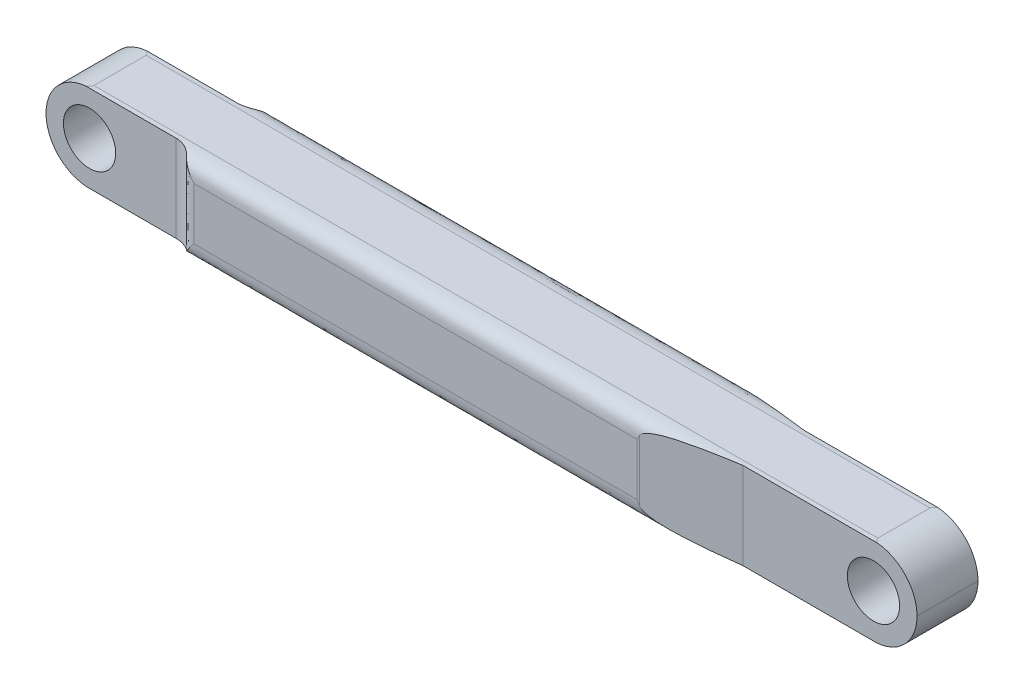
SolidWorks part; units mm, degrees
ref_plane "Front Plane" through (0, 0, 0) normal (0, 0, 1) x (1, 0, 0)
ref_plane "Top Plane" through (0, 0, 0) normal (0, 1, 0) x (1, 0, 0)
ref_plane "Right Plane" through (0, 0, 0) normal (1, 0, 0) x (0, 0, -1)
sketch "Sketch1" plane through (0, 0, 0) normal (0, 1, 0) x (1, 0, 0)
  line L1 (0, -35) -> (0, 35)
  line L2 (175, 50) -> (695, 50)
  line L3 (695, 50) -> (800, 35)
  line L5 (175, -50) -> (695, -50)
  line L6 (695, -50) -> (800, -35)
  line L7 (175, 50) -> (175, 35)
  line L8 (175, 35) -> (0, 35)
  line L9 (175, -50) -> (175, -35)
  line L10 (175, -35) -> (0, -35)
  line L11 (0, 0) -> (0, 35) construction
  line L12 (0, 35) -> (0, 0) construction
  line L13 (800, 35) -> (1000, 35)
  line L14 (1000, 35) -> (1000, -35)
  line L15 (1000, -35) -> (800, -35)
  dimension "D1" = 70
  dimension "D2" = 175
  dimension "D3" = 1000
  dimension "D4" = 520
  dimension "D5" = 100
  dimension "D6" = 35
  dimension "D7" = 70
  dimension "D8" = 200
extrude "Boss-Extrude3" add sketch "Sketch1" along normal blind 100
fillet "Fillet2" radius 50 2 edges at (0, 0, 0) (0, 100, 0)
fillet "Fillet3" radius 30 2 edges at (175, 50, 35) (175, 50, -35)
sketch "Sketch3" plane through (0, 0, -35) normal (0, 0, -1) x (-1, 0, 0)
  circle A0 centre (-50, 50) radius 30
  dimension "D1" = 60
extrude "Cut-Extrude1" cut sketch "Sketch3" against normal up to next
fillet "Fillet9" radius 50 2 edges at (1000, 0, 0) (1000, 100, 0)
sketch "Sketch7" plane through (0, 0, 35) normal (0, 0, 1) x (1, 0, 0)
  circle A0 centre (950, 50) radius 30
  dimension "D1" = 60
extrude "Cut-Extrude2" cut sketch "Sketch7" against normal up to next
fillet "Fillet10" radius 20 8 edges at (695, 50, -50) (435, 100, -50) (175, 50, -50) (435, 0, -50) (175, 50, 50) (435, 100, 50) (695, 50, 50) (435, 0, 50)
